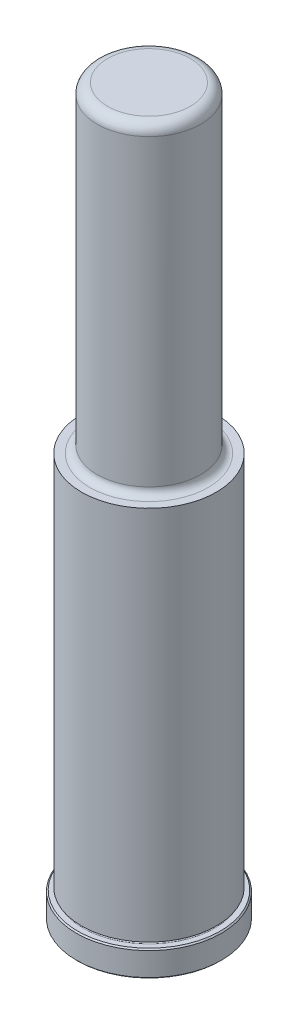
SolidWorks part; units mm, degrees
ref_plane "Front Plane" through (0, 0, 0) normal (0, 0, 1) x (1, 0, 0)
ref_plane "Top Plane" through (0, 0, 0) normal (0, 1, 0) x (1, 0, 0)
ref_plane "Right Plane" through (0, 0, 0) normal (1, 0, 0) x (0, 0, -1)
sketch "Sketch1" plane through (0, 0, 0) normal (1, 0, 0) x (0, 0, -1)
  line L0 (0, 0) -> (22.225, 0)
  line L1 (22.225, 0) -> (22.225, 7.9248)
  line L2 (22.225, 7.9248) -> (20.2438, 7.9248)
  line L3 (19.8628, 2.6782) -> (19.8628, 5.9795) construction
  line L4 (20.2438, 8.6868) -> (20.6502, 8.6868)
  line L5 (20.6502, 8.6868) -> (20.6502, 123.825)
  line L6 (20.6502, 123.825) -> (18.1483, 123.825)
  line L7 (15.8623, 126.111) -> (15.8623, 222.25)
  line L9 (15.8623, 222.25) -> (0, 222.25)
  line L10 (0, 222.25) -> (0, 0)
  line L11 (0, 0) -> (0, -7.2694) construction
  arc A0 (20.2438, 8.6868) -> (20.2438, 7.9248) centre (20.2438, 8.3058) ccw
  arc A1 (18.1483, 123.825) -> (15.8623, 126.111) centre (18.1483, 126.111) cw
  point P2 (15.8623, 222.25)
  point P14 (15.8623, 222.0042)
  point P19 (15.8623, 123.825)
  dimension "D14" = 0.762
  dimension "D8" = 2.286
  dimension "T" = 7.9248
  dimension "D2" = 0.762
  dimension "M" = 44.45
  dimension "B" = 41.3004
  dimension "L" = 222.25
  dimension "D7" = 0.7874
  dimension "A" = 123.825
  dimension "D" = 31.7246
  dimension "D15" = 98.425
revolve "Revolve1" add sketch "Sketch1" angle 360 about L11
chamfer "Chamfer1" distance 0.381 angle 45 2 edges at (0, 0, 22.225) (0, 7.9248, 22.225)
fillet "Fillet7" radius 3.175 1 edges at (0, 222.25, 15.8623)
